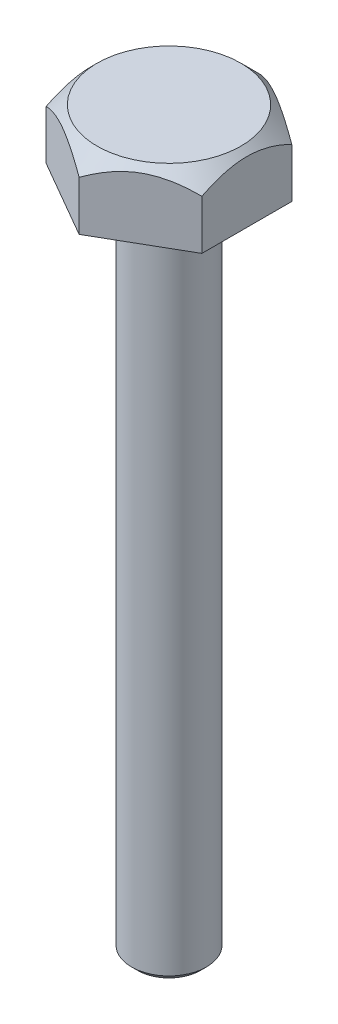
SolidWorks part; units mm, degrees
ref_plane "Front Plane" through (0, 0, 0) normal (0, 0, 1) x (1, 0, 0)
ref_plane "Top Plane" through (0, 0, 0) normal (0, 1, 0) x (1, 0, 0)
ref_plane "Right Plane" through (0, 0, 0) normal (1, 0, 0) x (0, 0, -1)
sketch "Sketch1" plane through (0, 0, 0) normal (0, 1, 0) x (1, 0, 0)
  line L1 (0, -60) -> (51.9615, -30)
  line L2 (51.9615, -30) -> (51.9615, 30)
  line L3 (51.9615, 30) -> (0, 60)
  line L4 (0, 60) -> (-51.9615, 30)
  line L5 (-51.9615, 30) -> (-51.9615, -30)
  line L6 (-51.9615, -30) -> (0, -60)
  circle A0 centre (0, 0) radius 51.9615 construction
  point P1 (-50.5522, -32.3184)
  dimension "D1" = 120
extrude "Boss-Extrude1" add sketch "Sketch1" along normal blind 45
sketch "Sketch2" plane through (0, 0, 0) normal (1, 0, 0) x (0, 0, -1)
  line L0 (48, 45) -> (60, 33)
  line L1 (60, 33) -> (60, 45)
  line L2 (60, 45) -> (48, 45)
  line L3 (0, 0) -> (0, 52.0713) construction
  circle A0 centre (60, 45) radius 12 construction
  dimension "D1" = 24
revolve "Cut-Revolve1" cut sketch "Sketch2" angle 360 about L3
sketch "Sketch3" plane through (0, 0, 0) normal (0, -1, 0) x (1, 0, 0)
  circle A0 centre (0, 0) radius 25
  dimension "D1" = 50
extrude "Boss-Extrude2" add sketch "Sketch3" along normal blind 445
chamfer "Chamfer1" distance 4 angle 45 1 edges at (0, -445, -25)
